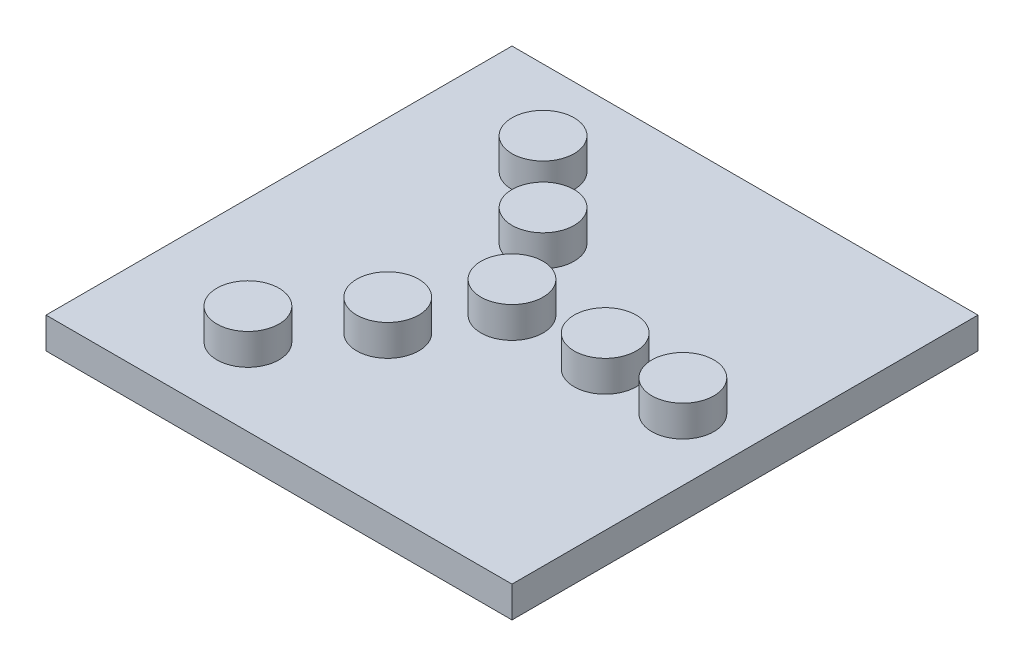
SolidWorks part; units mm, degrees
ref_plane "Front Plane" through (0, 0, 0) normal (0, 0, 1) x (1, 0, 0)
ref_plane "Top Plane" through (0, 0, 0) normal (0, 1, 0) x (1, 0, 0)
ref_plane "Right Plane" through (0, 0, 0) normal (1, 0, 0) x (0, 0, -1)
sketch "Sketch1" plane through (0, 0, 0) normal (0, 1, 0) x (1, 0, 0)
  line L0 (0, 0) -> (150, 0)
  line L1 (150, 0) -> (150, 150)
  line L2 (150, 150) -> (0, 150)
  line L3 (0, 150) -> (0, 0)
  dimension "D1" = 150
  dimension "D2" = 150
extrude "Extrude1" add sketch "Sketch1" along normal blind 10
sketch "Sketch3" plane through (0, 10, 0) normal (0, 1, 0) x (-1, 0, 0)
  line L1 (0, 0) -> (-150, 0) construction
  line L2 (-150, 0) -> (-150, -150) construction
  circle A0 centre (-75, -75) radius 10
  dimension "D1" = 20
  dimension "D2" = 75
  dimension "D3" = 75
extrude "Extrude2" add sketch "Sketch3" along normal blind 10
other "TPattern2" parameters "D0"=40, "D1"=25, "D2"=60, "D3"=50, "D4"=60, "D5"=100, "D6"=40, "D7"=120, "D8"=105, "D9"=75, "D10"=130, "D11"=75
